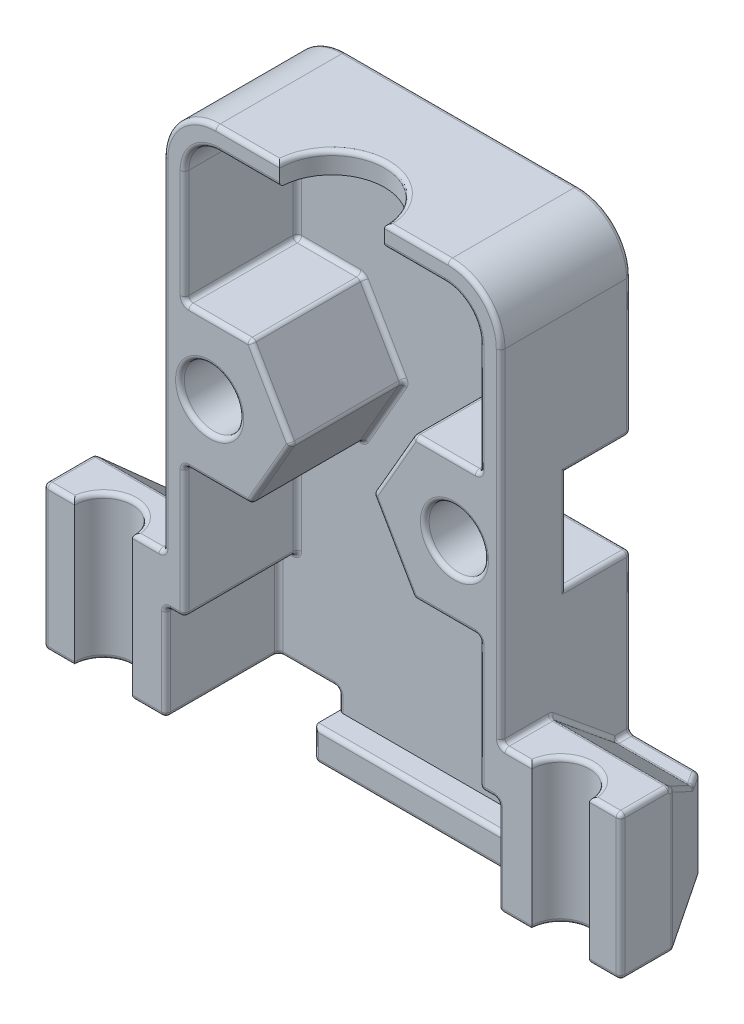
SolidWorks part; units mm, degrees
ref_plane "Front" through (0, 0, 0) normal (0, 0, 1) x (1, 0, 0)
ref_plane "Top" through (0, 0, 0) normal (0, 1, 0) x (1, 0, 0)
ref_plane "Right" through (0, 0, 0) normal (1, 0, 0) x (0, 0, -1)
sketch "Sketch1" plane through (0, 0, 0) normal (0, 0, 1) x (1, 0, 0)
  line L0 (-16.5, -3.6) -> (-9.6395, -3.6)
  line L1 (-6.075, -14.75) -> (6.075, -14.75)
  line L2 (-16.5, -11.85) -> (-16.5, -3.6)
  line L3 (-9.6395, 19.75) -> (9.6395, 19.75)
  line L4 (16.5, -11.85) -> (16.5, -3.6)
  line L7 (-9.6395, -3.6) -> (-9.6395, 19.75)
  line L8 (16.5, -3.6) -> (9.6395, -3.6)
  line L9 (9.6395, -3.6) -> (9.6395, 19.75)
  line L10 (-16.5, 18.4) -> (15.5, 18.4) construction
  line L11 (-6.075, -14.75) -> (-6.075, -11.85)
  line L12 (-6.075, -11.85) -> (-16.5, -11.85)
  line L13 (6.075, -14.75) -> (6.075, -11.85)
  line L14 (6.075, -11.85) -> (16.5, -11.85)
  point P0 (0, 0)
  point P19 (0, 0)
  point P21 (0, 0)
  dimension "D3" = 1.35
  dimension "D4" = 22
  dimension "D5" = 12.15
  dimension "D6" = 2.9
  dimension "D7" = 34.5
  dimension "D8" = 19.75
  dimension "D9" = 9.6395
  dimension "D10" = 9.6395
  dimension "D11" = 33
extrude "Extrude1" add sketch "Sketch1" along normal blind 7.45
sketch "Sketch2" plane through (-6.075, 0, 0) normal (-1, 0, 0) x (0, 0, 1)
  line L0 (7.45, -11.85) -> (0, -11.85) construction
  line L1 (7.45, -14.75) -> (2.4, -14.75)
  line L2 (7.45, -14.75) -> (7.45, -11.85)
  line L3 (7.45, -11.85) -> (2.4, -11.85)
  line L4 (2.4, -14.75) -> (2.4, -12.95)
  line L5 (1, -11.85) -> (1, -12.95)
  line L6 (0, -11.85) -> (0, -14.75) construction
  line L7 (7.45, -14.75) -> (0, -14.75) construction
  line L8 (2.4, -11.85) -> (1, -11.85)
  line L10 (1, -12.95) -> (2.4, -12.95)
  dimension "D1" = 2.4
  dimension "D2" = 1
  dimension "D3" = 1.8
extrude "Extrude2" cut sketch "Sketch2" against normal through all
sketch "Sketch3" plane through (-16.5, 0, 0) normal (-1, 0, 0) x (0, 0, 1)
  line L0 (7.45, -3.6) -> (0, -3.6) construction
  line L1 (0, -6.6) -> (1, -6.6)
  line L2 (0, -6.6) -> (0, -3.6)
  line L6 (1, -6.6) -> (4.65, -3.6)
  line L7 (7.45, -3.6) -> (0, -3.6) construction
  line L8 (4.65, -3.6) -> (0, -3.6)
  point P1 (3.2513, -11.3276)
  point P9 (0, -16.85)
  point P13 (1.6, -11.4129)
  point P15 (2.2345, -9)
  point P16 (0, 0)
  point P17 (0.0909, -9)
  dimension "D1" = 3
  dimension "D2" = 2.8
  dimension "D3" = 1
  dimension "D4" = 4.65
extrude "Extrude3" cut sketch "Sketch3" along direction (1, 0, 0) on the side against the normal up to surface (6.8605 mm away)
sketch "Sketch4" plane through (16.5, 0, 0) normal (1, 0, 0) x (0, 0, -1)
  line L0 (0, -6.6) -> (0, -3.6)
  line L1 (0, -3.6) -> (-4.65, -3.6)
  line L2 (-4.65, -3.6) -> (-1, -6.6)
  line L3 (-1, -6.6) -> (0, -6.6)
  point P4 (0, 0)
  point P11 (0, -16.85)
  point P13 (0, -11.4129)
  point P14 (-1.6, -11.4129)
  point P15 (-0.1047, -11.4129)
extrude "Extrude4" cut sketch "Sketch4" along direction (-1, 0, 0) on the side against the normal up to surface (6.8605 mm away)
sketch "Sketch5" plane through (0, 19.75, 0) normal (0, 1, 0) x (1, 0, 0)
  line L0 (0, -7.45) -> (0, 0) construction
  line L1 (9.6395, -7.45) -> (-9.6395, -7.45) construction
  circle A0 centre (0, -7.45) radius 3.5
  circle A1 centre (0, -7.45) radius 3
  circle A2 centre (0, -7.45) radius 13.1667
  dimension "D1" = 0.5
  dimension "D2" = 7
  dimension "D3" = 26.3335
extrude "Extrude6" cut sketch "Sketch5" against normal blind 0.8 contours A0 L0 M1 M2 M3 | L0 A0 M3 M4 M1 | L0 A1 M3 | L0 A1 M3 | A1 L0 A0 M3 | L0 A1 A0 M3
sketch "Sketch6" plane through (0, 18.95, 0) normal (0, 1, 0) x (1, 0, 0)
  line L0 (-16.5, -7.45) -> (-9.6395, -7.45) construction
  line L1 (-9.6395, -7.45) -> (9.6395, -7.45) construction
  line L2 (9.6395, -7.45) -> (16.5, -7.45) construction
  line L3 (-9.6395, -7.45) -> (9.6395, -7.45) construction
  circle A0 centre (-13.0698, -7.45) radius 1.65
  circle A1 centre (0, -7.45) radius 3
  circle A2 centre (13.0698, -7.45) radius 1.65
  point P14 (0, 0)
  point P15 (0, -7.45)
  point P18 (0, 0)
  point P19 (0, -7.45)
  dimension "D1" = 3.3
  dimension "D2" = 6
extrude "Extrude7" cut sketch "Sketch6" against normal through all
sketch "Sketch7" plane through (0, 0, 7.45) normal (0, 0, 1) x (1, 0, 0)
  line L0 (3, -11.85) -> (11.4198, -11.85) construction
  line L1 (-8.4395, 17.75) -> (8.4395, 17.75)
  line L2 (-8.4395, 17.75) -> (-8.4395, -11.85)
  line L3 (-8.4395, -11.85) -> (8.4395, -11.85)
  line L4 (8.4395, 17.75) -> (8.4395, -11.85)
  line L5 (-9.6395, 18.95) -> (-3, 18.95) construction
  line L6 (-9.6395, 18.95) -> (-9.6395, -3.6) construction
  line L7 (9.6395, -3.6) -> (9.6395, 18.95) construction
  point P6 (-6.3198, 18.95)
  dimension "D1" = 1.2
  dimension "D2" = 1.2
  dimension "D3" = 1.2
extrude "Extrude8" cut sketch "Sketch7" against normal up to surface (6.45 mm away)
fillet "Fillet1" radius 3 2 edges at (-9.6395, 18.95, 3.725) (9.6395, 18.95, 3.725)
sketch "Sketch10" plane through (0, 0, 0) normal (0, 0, -1) x (-1, 0, 0)
  line L0 (0, 27.9748) -> (0, -38.5843) construction
  line L2 (6.075, -14.75) -> (-6.075, -14.75) construction
  line L3 (-3.7091, 5.25) -> (-5.3546, 8.1)
  line L4 (-5.3546, 8.1) -> (-8.6454, 8.1)
  line L5 (-8.6454, 8.1) -> (-10.2909, 5.25) construction
  line L7 (-10.2909, 5.25) -> (-8.6454, 2.4) construction
  line L8 (-8.6454, 2.4) -> (-5.3546, 2.4)
  line L9 (-5.3546, 2.4) -> (-3.7091, 5.25)
  line L10 (-2.3235, 5.25) -> (-4.6617, 9.3)
  line L11 (-4.6617, 9.3) -> (-9.3383, 9.3)
  line L12 (-9.3383, 9.3) -> (-11.6765, 5.25) construction
  line L13 (-11.6765, 5.25) -> (-9.3383, 1.2) construction
  line L14 (-9.3383, 1.2) -> (-4.6617, 1.2)
  line L15 (-4.6617, 1.2) -> (-2.3235, 5.25)
  line L16 (-9.3383, 9.3) -> (-9.6395, 9.3)
  line L17 (-9.6395, -6.6) -> (-9.6395, 15.95) construction
  line L18 (-9.6395, 9.3) -> (-9.6395, 8.1)
  line L19 (-9.6395, 8.1) -> (-8.6454, 8.1)
  line L20 (-8.6454, 2.4) -> (-9.6395, 2.4)
  line L21 (-9.6395, 2.4) -> (-9.6395, 1.2)
  line L22 (-9.6395, 1.2) -> (-9.3383, 1.2)
  line L23 (11.6765, 5.25) -> (9.3383, 1.2) construction
  line L24 (9.3383, 9.3) -> (11.6765, 5.25) construction
  line L25 (10.2909, 5.25) -> (8.6454, 2.4) construction
  line L26 (8.6454, 8.1) -> (10.2909, 5.25) construction
  line L27 (9.6395, 1.2) -> (9.3383, 1.2)
  line L28 (9.6395, 2.4) -> (9.6395, 1.2)
  line L29 (8.6454, 2.4) -> (9.6395, 2.4)
  line L30 (9.6395, 8.1) -> (8.6454, 8.1)
  line L31 (9.6395, 9.3) -> (9.6395, 8.1)
  line L32 (9.3383, 9.3) -> (9.6395, 9.3)
  line L33 (4.6617, 1.2) -> (2.3235, 5.25)
  line L34 (9.3383, 1.2) -> (4.6617, 1.2)
  line L35 (4.6617, 9.3) -> (9.3383, 9.3)
  line L36 (2.3235, 5.25) -> (4.6617, 9.3)
  line L37 (9.6395, 15.95) -> (9.6395, -6.6) construction
  line L38 (-16.5, -11.85) -> (-16.5, -6.6) construction
  line L39 (-6.6395, 18.95) -> (6.6395, 18.95) construction
  line L41 (5.3546, 2.4) -> (3.7091, 5.25)
  line L42 (8.6454, 2.4) -> (5.3546, 2.4)
  line L43 (5.3546, 8.1) -> (8.6454, 8.1)
  line L44 (3.7091, 5.25) -> (5.3546, 8.1)
  circle A0 centre (-7, 5.25) radius 2.85 construction
  circle A1 centre (-7, 5.25) radius 4.05 construction
  circle A2 centre (7, 5.25) radius 4.05 construction
  circle A3 centre (7, 5.25) radius 2.85 construction
  dimension "D3" = 7
  dimension "D1" = 1.2
  dimension "D2" = 5.7
  dimension "D4" = 20
extrude "Extrude9" add sketch "Sketch10" against normal up to surface (7.45 mm away) contours L44 L41 L42 L29 L30 L43 M1 | L41 L44 L43 L30 L32 L35 L36 L33 L34 L27 L29 L42 M1 | L22 L14 L15 L10 L11 L16 L19 L4 L3 L9 L8 L20 M5 | L20 L8 L9 L3 L4 L19 M5
sketch "Sketch11" plane through (0, 0, 0) normal (0, 0, -1) x (-1, 0, 0)
  line L0 (-9.6395, 8.1) -> (-5.3546, 8.1)
  line L1 (-5.3546, 8.1) -> (-3.7091, 5.25)
  line L2 (-3.7091, 5.25) -> (-5.3546, 2.4)
  line L3 (-5.3546, 2.4) -> (-3.7091, 5.25) construction
  line L4 (-5.3546, 2.4) -> (-9.6395, 2.4)
  line L5 (-9.6395, 8.1) -> (-9.6395, 2.4)
  line L6 (0, 10.4929) -> (0, -7.285) construction
  line L7 (0, 27.9748) -> (0, -38.5843) construction
  line L8 (9.6395, 8.1) -> (9.6395, 2.4)
  line L9 (5.3546, 2.4) -> (9.6395, 2.4)
  line L11 (3.7091, 5.25) -> (5.3546, 2.4)
  line L12 (5.3546, 8.1) -> (3.7091, 5.25)
  line L13 (9.6395, 8.1) -> (5.3546, 8.1)
extrude "Extrude10" cut sketch "Sketch11" against normal blind 3.7
sketch "Sketch12" plane through (0, 0, 3.7) normal (0, 0, -1) x (-1, 0, 0)
  line L0 (-7, 5.25) -> (7, 5.25) construction
  circle A0 centre (-7, 5.25) radius 1.7
  circle A1 centre (7, 5.25) radius 1.7
  point P6 (0, 0)
  point P8 (0, 0)
  dimension "D1" = 3.4
  dimension "D2" = 14
extrude "Extrude11" cut sketch "Sketch12" against normal through all
sketch "Эскиз1" plane through (0, 0, 7.45) normal (0, 0, 1) x (1, 0, 0)
  line L2 (-9.5, -6.35) -> (9.5, -6.35)
  line L3 (-9.5, -6.35) -> (-9.5, -11.85)
  line L4 (-9.5, -11.85) -> (9.5, -11.85)
  line L6 (0, 42.3467) -> (0, -42.3467) construction
  line L7 (9.5, -6.35) -> (9.5, -11.85)
  line L8 (-11.4198, -11.85) -> (-8.4395, -11.85) construction
  point P1 (0, 0)
  point P5 (0, 0)
  point P6 (0, 0)
  point P9 (0, 0)
  point P12 (0, -11.85)
  point P14 (0, -6.35)
  point P15 (0, 0)
  point P17 (-9.9297, -11.85)
  dimension "D1" = 9.5
  dimension "D2" = 5.5
extrude "Вырез-Вытянуть1" cut sketch "Эскиз1" against normal up to surface (6.45 mm away)
fillet "Скругление1" radius 2 2 edges at (8.4395, 17.75, 4.225) (-8.4395, 17.75, 4.225)
sketch "Эскиз2" plane through (0, -11.85, 0) normal (0, -1, 0) x (1, 0, 0)
  line L0 (16.5, 0) -> (16.5, 4.5)
  line L1 (16.5, 7.45) -> (16.5, 0) construction
  line L2 (16.5, 4.5) -> (13.5, 0)
  line L3 (6.075, 0) -> (16.5, 0) construction
  line L4 (13.5, 0) -> (16.5, 0)
  dimension "D1" = 4.5
  dimension "D2" = 3
extrude "Вырез-Вытянуть2" cut sketch "Эскиз2" against normal through all
sketch "Эскиз3" plane through (0, -11.85, 0) normal (0, -1, 0) x (1, 0, 0)
  line L0 (-16.5, 0) -> (-16.5, 4.5)
  line L1 (-16.5, 7.45) -> (-16.5, 0) construction
  line L2 (-16.5, 0) -> (-6.075, 0) construction
  line L3 (-16.5, 4.5) -> (-13.5, 0)
  line L4 (-13.5, 0) -> (-16.5, 0)
  line L5 (16.5, 0) -> (16.5, 4.5) construction
  line L6 (13.5, 0) -> (16.5, 0) construction
extrude "Вырез-Вытянуть3" cut sketch "Эскиз3" against normal through all
fillet "Fillet4" radius 0.25 142 edges at (-15.6099, -3.6, 7.45) (-13.0698, -3.6, 5.8) (-10.4599, -11.85, 7.45) (-13.0698, -11.85, 5.8) (4.8198, 18.95, 7.45) (0, 18.95, 4.45) (9.6395, -2.1, 0) (10.5297, -3.6, 7.45) (13.0698, -3.6, 5.8) (15.6099, -11.85, 7.45) (13.0698, -11.85, 5.8) (9.7875, -11.85, 0) (6.075, -13.3, 0) (-4.7198, 17.75, 7.45) (0, -14.75, 0) (-7.7875, -11.85, 1) (7.7875, -11.85, 1) (-6.075, -13.3, 0) (0, 18.95, 0) (-4.8198, 18.95, 7.45) (-9.6395, 6.175, 7.45) (-8.7609, 18.0713, 7.45) (-9.6395, 12.025, 0) (8.7609, 18.0713, 0) (-8.7609, 18.0713, 0) (8.7609, 18.0713, 7.45) (-8.4395, -2.575, 7.45) (-8.4395, -2.575, 1) (-8.4395, 9.3, 4.225) (-8.4395, 1.2, 4.225) (-3.4926, 7.275, 1) (-3.4926, 3.225, 1) (-4.6617, 1.2, 4.225) (-3.4926, 3.225, 7.45) (-2.3235, 5.25, 4.225) (-3.4926, 7.275, 7.45) (-6.5506, 1.2, 1) (-6.5506, 1.2, 7.45) (-4.6617, 9.3, 4.225) (-6.5506, 9.3, 1) (-6.5506, 9.3, 7.45) (-16.5, -3.6, 6.05) (-9.6395, -3.6, 6.05) (8.4395, 12.525, 7.45) (8.4395, 12.525, 1) (8.4395, 1.2, 4.225) (9.6395, -3.6, 6.05) (8.4395, 9.3, 4.225) (16.5, -3.6, 6.05) (16.5, -11.85, 5.975) (-16.5, -11.85, 5.975) (4.6617, 9.3, 4.225) (2.3235, 5.25, 4.225) (4.6617, 1.2, 4.225) (6.5506, 1.2, 7.45) (6.5506, 9.3, 7.45) (3.4926, 7.275, 7.45) (3.4926, 3.225, 7.45) (6.5506, 9.3, 1) (3.4926, 7.275, 1) (3.4926, 3.225, 1) (6.5506, 1.2, 1) (16.5, -7.725, 7.45) (9.6395, 12.025, 0) (9.6395, 5.25, 3.7) (9.6395, 2.4, 1.85) (9.6395, 8.1, 1.85) (7.497, 2.4, 0) (4.5318, 3.825, 0) (4.5318, 6.675, 0) (7.497, 8.1, 0) (-9.6395, -2.1, 0) (-9.6395, 5.25, 3.7) (-9.6395, 8.1, 1.85) (-9.6395, 2.4, 1.85) (-7.497, 8.1, 0) (-4.5318, 6.675, 0) (-4.5318, 3.825, 0) (-7.497, 2.4, 0) (15.6099, -3.6, 7.45) (5.3, 5.25, 7.45) (-8.7, 5.25, 7.45) (8.4395, -2.575, 7.45) (8.4395, -2.575, 1) (8.4395, -6.35, 4.225) (10.4599, -11.85, 7.45) (9.6395, 6.175, 7.45) (-8.9698, -6.35, 7.45) (-9.5, -9.1, 7.45) (8.9698, -6.35, 7.45) (9.5, -9.1, 7.45) (9.5, -11.85, 4.225) (-8.4395, -6.35, 4.225) (-8.9698, -6.35, 1) (-9.5, -6.35, 4.225) (8.9698, -6.35, 1) (9.5, -9.1, 1) (9.5, -6.35, 4.225) (-9.5, -9.1, 1) (-9.5, -11.85, 4.225) (0, 17.75, 1) (4.7198, 17.75, 7.45) (-8.4395, 12.525, 1) (-7.8538, 17.1642, 1) (7.8538, 17.1642, 1) (-8.4395, 12.525, 7.45) (7.8538, 17.1642, 7.45) (-7.8538, 17.1642, 7.45) (13.8333, -6.6, 0.5) (15.3333, -5.1616, 2.75) (13.5, -9.225, 0) (16.5, -7.7866, 4.5) (15, -11.85, 2.25) (-16.5, -3.6616, 4.575) (-15.3333, -5.1616, 2.75) (-9.7875, -11.85, 0) (-13.5, -9.225, 0) (-13.8333, -6.6, 0.5) (-16.5, -7.7866, 4.5) (-15, -11.85, 2.25) (6.075, -11.85, 0.5) (6.075, -14.75, 1.2) (6.075, -13.85, 2.4) (-6.075, -14.75, 1.2) (-10.5297, -3.6, 7.45) (-6.075, -11.85, 0.5) (0, -14.75, 2.4) (0, -12.95, 2.4) (6.075, -12.4, 1) (-16.5, -7.725, 7.45) (-6.075, -12.4, 1) (-6.075, -13.85, 2.4) (-9.6395, -6.6, 0.5) (-9.6395, -5.1, 2.825) (-13.0698, -3.6, 4.65) (-11.5698, -6.6, 0) (-15.6099, -11.85, 7.45) (16.5, -3.6616, 4.575) (13.0698, -3.6, 4.65) (9.6395, -5.1, 2.825) (9.6395, -6.6, 0.5) (11.5698, -6.6, 0)
